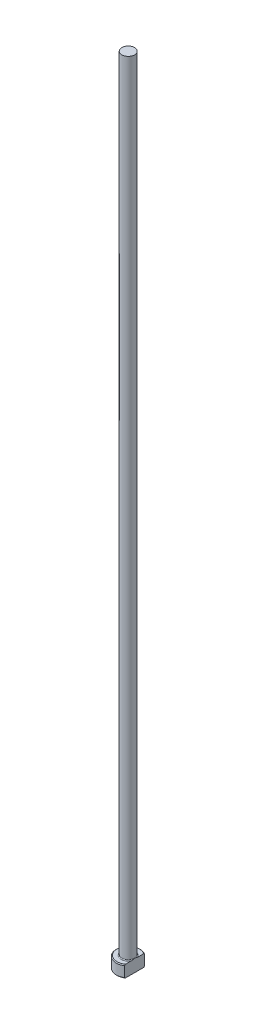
SolidWorks part; units mm, degrees
ref_plane "Front Plane" through (0, 0, 0) normal (0, 0, 1) x (1, 0, 0)
ref_plane "Top Plane" through (0, 0, 0) normal (0, 1, 0) x (1, 0, 0)
ref_plane "Right Plane" through (0, 0, 0) normal (1, 0, 0) x (0, 0, -1)
sketch "Sketch1" plane through (0, 0, 0) normal (0, 0, 1) x (1, 0, 0)
  line L0 (0, 259.9588) -> (0, -15.1925) construction
  line L1 (0, 0) -> (-3, 0)
  line L2 (-3, 0) -> (-3, 3)
  line L3 (-3, 3) -> (-1.6, 3)
  line L4 (-1.6, 3) -> (-1.6, 200)
  line L5 (-1.6, 200) -> (0, 200)
  line L6 (0, 200) -> (0, 0)
  dimension "L" = 200
  dimension "H" = 6
  dimension "T" = 3
  dimension "D" = 3.2
revolve "Revolve1" add sketch "Sketch1" angle 360 about L0
chamfer "Chamfer1" distance 0.2 angle 45 2 edges at (0, 3, 3) (0, 0, 3)
fillet "Fillet1" radius 0.2 1 edges at (0, 3, 1.6)
sketch "Sketch2" plane through (0, 0, 0) normal (0, 1, 0) x (1, 0, 0)
  line L0 (1.6, 2.5377) -> (1.6, -2.5377)
  circle A0 centre (0, 0) radius 3 construction
  arc A1 (1.6, -2.5377) -> (1.6, 2.5377) centre (0, 0) ccw
  circle A2 centre (0, 0) radius 1.6 construction
extrude "KEY" cut sketch "Sketch2" along normal through all
